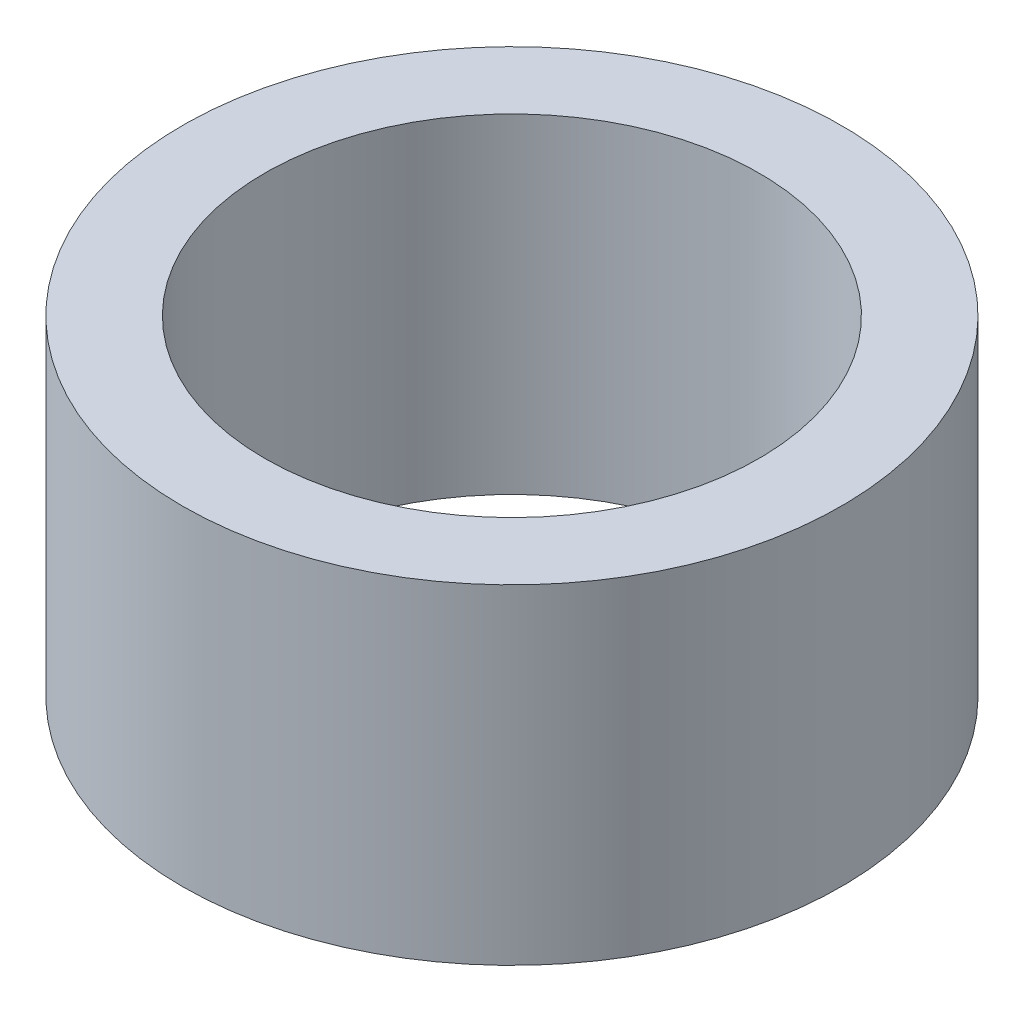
SolidWorks part; units mm, degrees
ref_plane "前视基准面" through (0, 0, 0) normal (0, 0, 1) x (1, 0, 0)
ref_plane "上视基准面" through (0, 0, 0) normal (0, 1, 0) x (1, 0, 0)
ref_plane "右视基准面" through (0, 0, 0) normal (1, 0, 0) x (0, 0, -1)
sketch "草图1" plane through (0, 0, 0) normal (0, 1, 0) x (1, 0, 0)
  circle A0 centre (0, 0) radius 9
  circle A1 centre (0, 0) radius 12
  dimension "D1" = 18
  dimension "D2" = 24
extrude "凸台-拉伸1" add sketch "草图1" along normal mid plane 12
